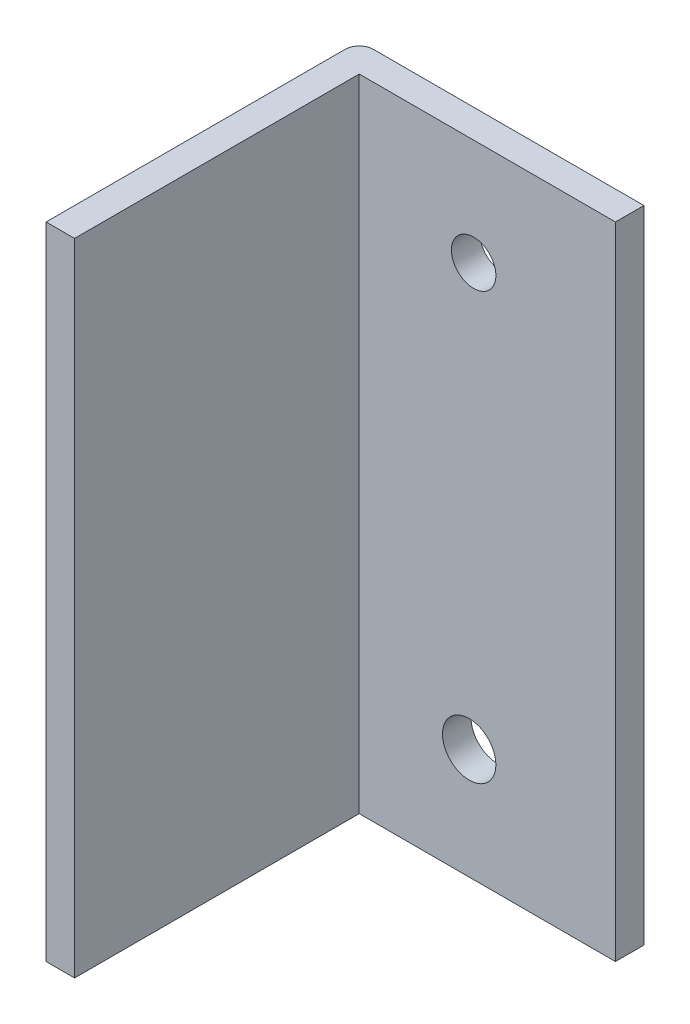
SolidWorks part; units mm, degrees
ref_plane "Front" through (0, 0, 0) normal (0, 0, 1) x (1, 0, 0)
ref_plane "Top" through (0, 0, 0) normal (0, 1, 0) x (1, 0, 0)
ref_plane "Right" through (0, 0, 0) normal (1, 0, 0) x (0, 0, -1)
sketch "Sketch2" plane through (0, 0, 0) normal (0, 0, 1) x (1, 0, 0)
  line L1 (-25.4, -57.15) -> (25.4, -57.15)
  line L2 (-25.4, -57.15) -> (-25.4, 57.15)
  line L3 (-25.4, 57.15) -> (25.4, 57.15)
  line L4 (25.4, -57.15) -> (25.4, 57.15)
  line L5 (-25.4, -57.15) -> (25.4, 57.15) construction
  line L6 (-25.4, 57.15) -> (25.4, -57.15) construction
  point P0 (0, 0)
  dimension "D1" = 114.3
  dimension "D2" = 50.8
extrude "Boss-Extrude1" add sketch "Sketch2" along normal blind 5.08
sketch "Sketch3" plane through (-25.4, 0, 0) normal (-1, 0, 0) x (0, 0, 1)
  line L0 (5.08, 57.15) -> (55.88, 57.15)
  line L1 (55.88, 57.15) -> (55.88, -57.15)
  line L2 (55.88, -57.15) -> (5.08, -57.15)
  line L3 (5.08, -57.15) -> (5.08, 57.15)
  dimension "D1" = 50.8
extrude "Boss-Extrude2" add sketch "Sketch3" against normal blind 5.08
fillet "Fillet1" radius 2.54 1 edges at (-25.4, 0, 0)
sketch "Sketch4" plane through (0, 0, 5.08) normal (0, 0, 1) x (1, 0, 0)
  circle A0 centre (0.0952, 38.1953) radius 3.9688
  circle A1 centre (-0.6985, -37.4015) radius 4.7625
  dimension "D1" = 7.9375
  dimension "D2" = 9.525
extrude "Cut-Extrude1" cut sketch "Sketch4" against normal through all contours A0 | A1
